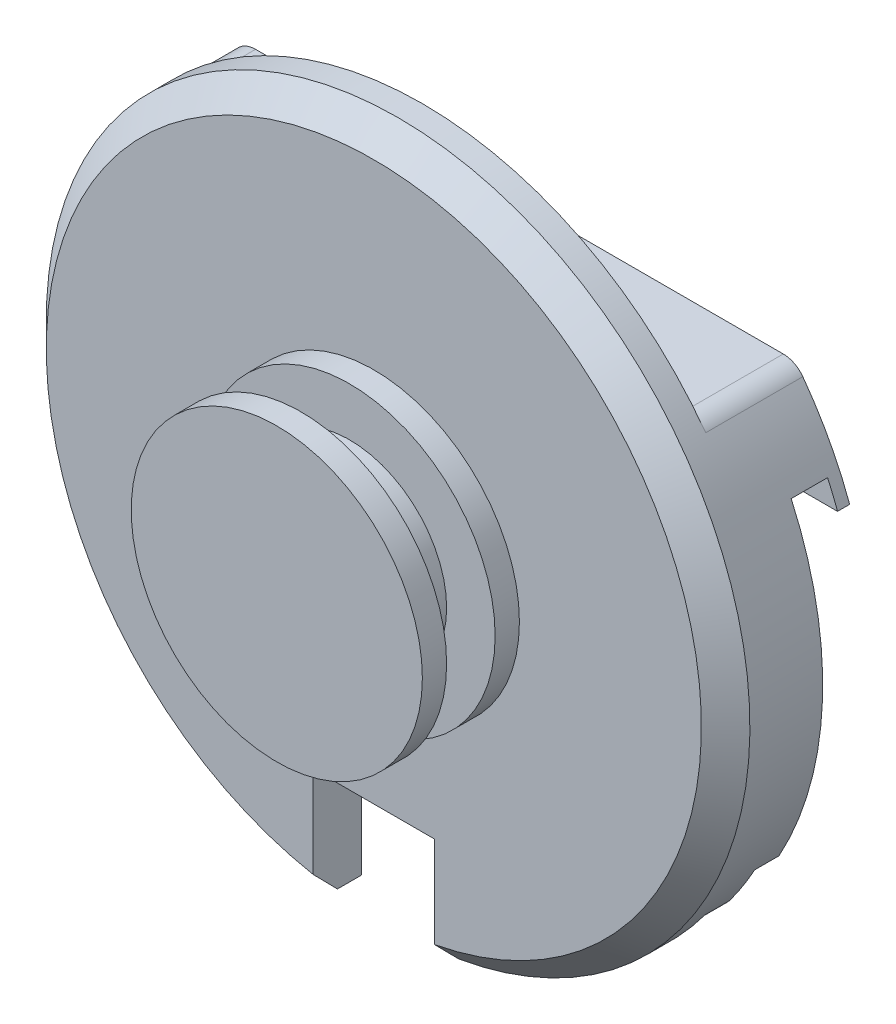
SolidWorks part; units mm, degrees
ref_plane "Front Plane" through (0, 0, 0) normal (0, 0, 1) x (1, 0, 0)
ref_plane "Top Plane" through (0, 0, 0) normal (0, 1, 0) x (1, 0, 0)
ref_plane "Right Plane" through (0, 0, 0) normal (1, 0, 0) x (0, 0, -1)
sketch "Sketch1" plane through (0, 0, 0) normal (0, 0, 1) x (1, 0, 0)
  circle A0 centre (0, 0) radius 14.5
  dimension "D1" = 29
extrude "Extrude1" add sketch "Sketch1" along normal blind 2
chamfer "Chamfer1" distance 1 angle 45 1 edges at (14.5, 0, 2)
sketch "Sketch2" plane through (0, 0, 2) normal (0, 0, 1) x (1, 0, 0)
  circle A0 centre (0, 0) radius 6
  dimension "D1" = 12
extrude "Extrude2" add sketch "Sketch2" along normal blind 1
sketch "Sketch3" plane through (0, 0, 3) normal (0, 0, 1) x (1, 0, 0)
  circle A0 centre (0, 0) radius 4
  dimension "D1" = 8
extrude "Extrude3" add sketch "Sketch3" along normal blind 2
sketch "Sketch4" plane through (0.3898, -0.9593, 5) normal (0, 0, 1) x (1, 0, 0)
  circle A1 centre (-0.3898, 0.9593) radius 6
  circle A2 centre (-0.3898, 0.9593) radius 6
  dimension "D1" = 0
extrude "Extrude4" add sketch "Sketch4" along normal blind 1
sketch "Sketch5" plane through (0, 0, 0) normal (0, 0, -1) x (-1, 0, 0)
  line L0 (-11.3688, 9) -> (11.3688, 9)
  line L1 (-12.6984, -7) -> (12.6984, -7)
  line L2 (0, 0) -> (7.7671, 0) construction
  arc A0 (-11.3688, 9) -> (-12.6984, -7) centre (0, 0) ccw
  circle A1 centre (0, 0) radius 14.5
  arc A2 (12.6984, -7) -> (11.3688, 9) centre (0, 0) ccw
  dimension "D2" = 9
  dimension "D3" = 7
  dimension "D1" = 0
extrude "Extrude5" add sketch "Sketch5" along normal blind 2
sketch "Sketch6" plane through (0, 0, -2) normal (0, 0, -1) x (-1, 0, 0)
  circle A0 centre (0, 0) radius 2
  dimension "D1" = 4
extrude "Cut-Extrude1" cut sketch "Sketch6" against normal blind 7 draft 5
sketch "Sketch7" plane through (0, 0, 0) normal (1, 0, 0) x (0, 0, -1)
  line L0 (2, 9) -> (4, 9)
  line L1 (4, 9) -> (4, 5)
  line L2 (4, 5) -> (3.5, 5)
  line L3 (3.5, 5) -> (3.5, 6)
  line L4 (3.5, 6) -> (2, 6)
  line L5 (2, -7) -> (2, 9) construction
  line L6 (2, 6) -> (2, 9)
  dimension "D1" = 2
  dimension "D2" = 4
  dimension "D3" = 1
  dimension "D4" = 0.5
extrude "Extrude6" add sketch "Sketch7" along normal up to surface and the other way up to surface
sketch "Sketch8" plane through (0, 2, 0) normal (-1, 0, 0) x (0, 0, -1)
  line L0 (2, 9) -> (4, 9)
  line L1 (4, 9) -> (4, 5)
  line L2 (4, 5) -> (3.5, 5)
  line L3 (3.5, 5) -> (3.5, 6)
  line L4 (3.5, 6) -> (2, 6)
  line L5 (2, -4) -> (2, 9) construction
  line L6 (2, 6) -> (2, 9)
  line L7 (2, 9) -> (0, 9) construction
extrude "Extrude7" add sketch "Sketch8" along normal mid plane 12
sketch "Sketch9" plane through (0, 0, 0) normal (0, 0, -1) x (-1, 0, 0)
  line L0 (-11.3688, -9) -> (-6.5, -9)
  line L1 (12.6984, -7) -> (-12.6984, -7)
  line L2 (12.6984, -7) -> (-12.6984, -7)
  line L3 (-6.5, -9) -> (-6.5, -10)
  line L4 (-6.5, -10) -> (6.5, -10)
  line L5 (6.5, -10) -> (6.5, -9)
  line L6 (6.5, -9) -> (11.3688, -9)
  line L7 (0, 0) -> (0, -10) construction
  arc A0 (11.3688, -9) -> (12.6984, -7) centre (0, 0) ccw
  arc A1 (-12.6984, -7) -> (12.6984, -7) centre (0, 0) ccw
  arc A2 (-12.6984, -7) -> (-11.3688, -9) centre (0, 0) ccw
  point P5 (-17.6721, 1.6646)
  dimension "D2" = 9
  dimension "D3" = 10
  dimension "D4" = 13
  dimension "D1" = 0
extrude "Extrude8" add sketch "Sketch9" along normal blind 1
sketch "Sketch10" plane through (0, 0, -1) normal (0, 0, -1) x (-1, 0, 0)
  line L0 (-5, -8.5) -> (5, -8.5)
  line L1 (0, 0) -> (0, -8.5) construction
  arc A0 (-11.3688, -9) -> (11.3688, -9) centre (0, 0) ccw construction
  dimension "D2" = 6
  dimension "D1" = 10
extrude "Extrude-Thin1" add sketch "Sketch10" along normal blind 8 thin
sketch "Sketch11" plane through (0, -9.5, 0) normal (0, 1, 0) x (-1, 0, 0)
  line L0 (13.5, 2) -> (-13.5, 2) construction
  line L1 (2.5, 2) -> (-2.5, 2)
  line L3 (2.5, -9) -> (-2.5, -9)
  line L4 (-2.5, -9) -> (-2.5, 2)
  line L5 (2.5, 2) -> (2.5, -9)
  line L6 (0, 0) -> (0, -9) construction
  line L7 (-5, -9) -> (5, -9) construction
  dimension "D1" = 5
extrude "Cut-Extrude3" cut sketch "Sketch11" against normal through all
fillet "Fillet1" radius 1 4 edges at (11.3688, -9, -0.5) (-11.3688, -9, -0.5)
